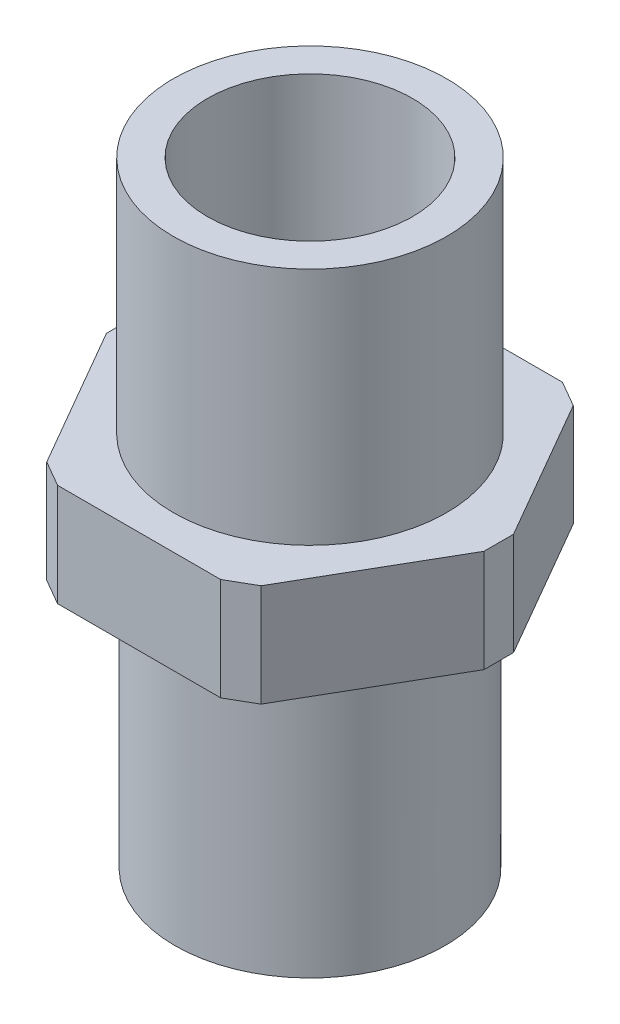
SolidWorks part; units mm, degrees
ref_plane "Plan de face" through (0, 0, 0) normal (0, 0, 1) x (1, 0, 0)
ref_plane "Plan de dessus" through (0, 0, 0) normal (0, 1, 0) x (1, 0, 0)
ref_plane "Plan de droite" through (0, 0, 0) normal (1, 0, 0) x (0, 0, -1)
sketch "Esquisse1" plane through (0, 0, 0) normal (0, 1, 0) x (1, 0, 0)
  line L1 (5.7735, 0) -> (2.8868, 5)
  line L2 (2.8868, 5) -> (-2.8868, 5)
  line L3 (-2.8868, 5) -> (-5.7735, 0)
  line L4 (-5.7735, 0) -> (-2.8868, -5)
  line L5 (-2.8868, -5) -> (2.8868, -5)
  line L6 (2.8868, -5) -> (5.7735, 0)
  circle A0 centre (0, 0) radius 5 construction
  dimension "D1" = 10
extrude "Extrusion1" add sketch "Esquisse1" along normal blind 3
sketch "Esquisse2" plane through (0, 3, 0) normal (0, 1, 0) x (1, 0, 0)
  circle A0 centre (0, 0) radius 4
  circle A1 centre (0, 0) radius 3
  dimension "D1" = 8
  dimension "D2" = 1
extrude "Extrusion2" add sketch "Esquisse2" along normal blind 7
sketch "Esquisse3" plane through (0, 0, 0) normal (0, -1, 0) x (1, 0, 0)
  circle A0 centre (0, 0) radius 3.95
  dimension "D1" = 7.9
extrude "Extrusion3" add sketch "Esquisse3" along normal blind 8
chamfer "Chanfrein1" distance 0.5 distance2 0.5 6 edges at (2.8868, 1.5, 5) (5.7735, 1.5, 0) (2.8868, 1.5, -5) (-2.8868, 1.5, -5) (-2.8868, 1.5, 5) (-5.7735, 1.5, 0)
